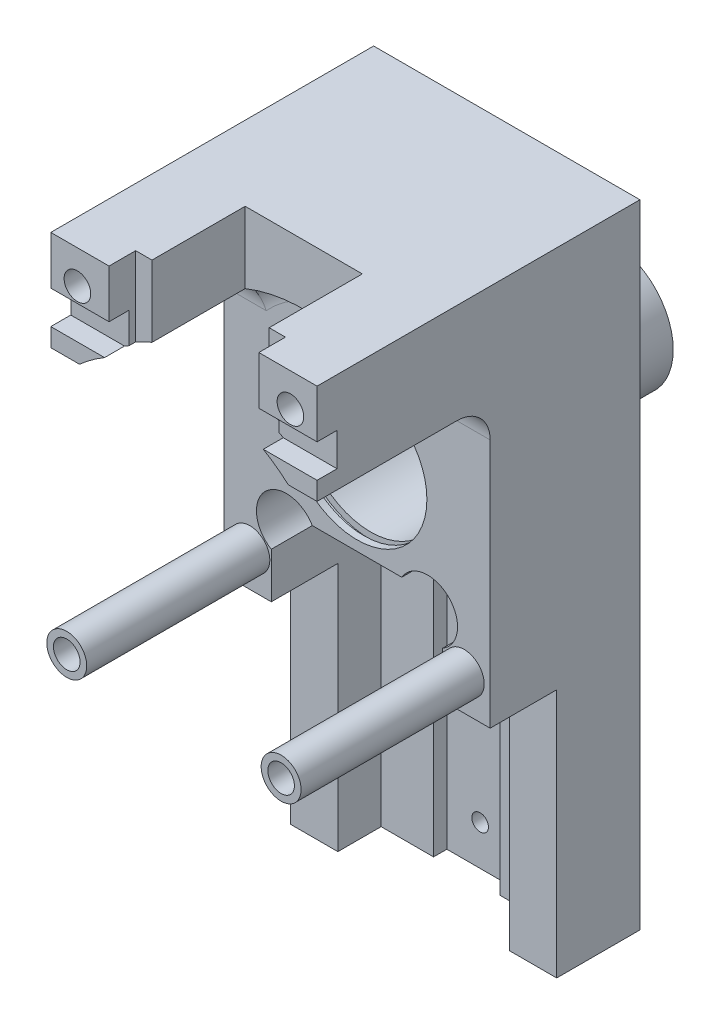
SolidWorks part; units mm, degrees
ref_plane "Ebene vorne" through (0, 0, 0) normal (0, 0, 1) x (1, 0, 0)
ref_plane "Ebene oben" through (0, 0, 0) normal (0, 1, 0) x (1, 0, 0)
ref_plane "Ebene rechts" through (0, 0, 0) normal (1, 0, 0) x (0, 0, -1)
sketch "Skizze1" plane through (0, 0, 0) normal (1, 0, 0) x (0, 0, -1)
  line L0 (-52, 72.5) -> (45, 72.5)
  line L1 (45, 72.5) -> (45, -117.5)
  line L2 (45, -117.5) -> (20, -117.5)
  line L3 (20, -117.5) -> (20, -42.5)
  line L4 (20, -42.5) -> (0, -42.5)
  line L5 (0, -42.5) -> (0, 42.5)
  line L6 (0, 42.5) -> (-52, 42.5)
  line L7 (-52, 42.5) -> (-52, 48)
  line L8 (-52, 48) -> (-46, 48)
  line L9 (-46, 48) -> (-46, 58)
  line L10 (-46, 58) -> (-52, 58)
  line L11 (-52, 58) -> (-52, 72.5)
  dimension "D1" = 85
  dimension "D2" = 190
  dimension "D3" = 97
  dimension "D4" = 25
  dimension "D5" = 75
  dimension "D6" = 45
  dimension "D7" = 91
  dimension "D8" = 10
  dimension "D9" = 14.5
extrude "Linear austragen1" add sketch "Skizze1" along normal mid plane 80
sketch "Skizze2" plane through (0, 0, -45) normal (0, 0, -1) x (-1, 0, 0)
  line L0 (0, -117.5) -> (0, 0) construction
  line L1 (-40, -117.5) -> (40, -117.5) construction
  circle A0 centre (0, 7.5) radius 19
  dimension "D1" = 38
  dimension "D2" = 125
extrude "Linear austragen2" add sketch "Skizze2" along normal blind 31
sketch "Skizze3" plane through (0, 0, -76) normal (0, 0, -1) x (-1, 0, 0)
  circle A0 centre (0, 7.5) radius 11.5
  dimension "D1" = 23
extrude "Schnitt-Linear austragen1" cut sketch "Skizze3" against normal up to next
sketch "Skizze4" plane through (0, 0, 0) normal (0, 0, 1) x (1, 0, 0)
  circle A0 centre (0, 7.5) radius 21
  dimension "D1" = 42
extrude "Schnitt-Linear austragen2" cut sketch "Skizze4" against normal blind 34
sketch "Skizze5" plane through (0, 0, -34) normal (0, 0, 1) x (1, 0, 0)
  circle A0 centre (0, 7.5) radius 18
  dimension "D1" = 36
extrude "Schnitt-Linear austragen3" cut sketch "Skizze5" against normal blind 4
ref_plane "Ebene1" through (0, 7.5, 0) normal (0, -1, 0) x (1, 0, 0)
sketch "Skizze7" plane through (0, 7.5, 0) normal (0, -1, 0) x (1, 0, 0)
  line L0 (21, 0) -> (-21, 0) construction
  line L1 (21, 0) -> (-21, 0) construction
  line L2 (21, -2.1) -> (23, -2.1)
  line L3 (23, -2.1) -> (23, -4.1)
  line L4 (23, -4.1) -> (21, -4.1)
  line L5 (21, -4.1) -> (21, -2.1)
  line L6 (40, 0) -> (-40, 0) construction
  line L7 (21, 0) -> (21, -20) construction
  line L8 (40, -20) -> (-40, -20) construction
  dimension "D1" = 4.1
  dimension "D2" = 2
  dimension "D3" = 2
ref_plane "Ebene2" through (0, 0, -4) normal (0, 0, 1) x (1, 0, 0)
sketch "Skizze8" plane through (0, 0, -4) normal (0, 0, 1) x (1, 0, 0)
  line L0 (21, 7.5) -> (-21, 7.5) construction
  circle A0 centre (0, 7.5) radius 17.5984
  dimension "D1" = 35.1967
sweep "Schnitt-Austragung1" cut profiles "Skizze7" path "Skizze8"
sketch "Skizze9" plane through (0, 0, 52) normal (0, 0, 1) x (1, 0, 0)
  line L1 (40, 72.5) -> (-40, 72.5) construction
  circle A0 centre (0, 7.5) radius 47
  dimension "D1" = 18
extrude "Schnitt-Linear austragen4" cut sketch "Skizze9" against normal up to surface (52 mm away)
sketch "Skizze12" plane through (0, 0, 52) normal (0, 0, 1) x (1, 0, 0)
  line L0 (0, 72.5) -> (0, -42.5) construction
  line L1 (40, 72.5) -> (-40, 72.5) construction
  line L2 (40, -42.5) -> (-40, -42.5) construction
  line L4 (-17.6, 72.5) -> (17.6, 72.5)
  line L5 (-17.6, 72.5) -> (-17.6, 47.5)
  line L6 (-17.6, 47.5) -> (17.6, 47.5)
  line L7 (17.6, 72.5) -> (17.6, 47.5)
  dimension "D1" = 25
  dimension "D2" = 35.2
extrude "Schnitt-Linear austragen5" cut sketch "Skizze12" against normal blind 36
fillet "Verrundung1" radius 10 3 edges at (35.6844, 42.5, 0) (-35.6844, 42.5, 0) (0, 54.5, 0)
hole_wizard "M8x1.25 Gewindebohrung1" positions "Skizze14" profile "Skizze13" tap size "M8x1.25" standard "Ansi Metrisch"
sketch "Skizze14" plane through (0, 0, 52) normal (0, 0, 1) x (1, 0, 0)
  line L0 (0, 72.5) -> (0, 0) construction
  line L1 (17.6, 72.5) -> (-17.6, 72.5) construction
  line L3 (-17.6, 72.5) -> (-40, 72.5) construction
  point P0 (32, 62.5)
  point P1 (-32, 62.5)
  dimension "D1" = 64
  dimension "D2" = 10
sketch "Skizze13" plane through (32, 62.5, 52) normal (1, 0, 0) x (0, -1, 0)
  line L0 (0, 0) -> (0, 24.2929)
  line L1 (0, 24.2929) -> (3.4, 22.25)
  line L2 (3.4, 22.25) -> (3.4, 16)
  line L3 (3.4, 16) -> (4, 16)
  line L4 (4, 16) -> (4, 0)
  line L5 (4, 0) -> (0, 0)
  line L10 (0, 24.2929) -> (-3.4, 22.25) construction
  line L11 (0, -6.35) -> (0, 107.95) construction
  dimension "Bohrerdurchmesser" = 6.8
  dimension "Bohrungstiefe" = 22.25
  dimension "Nenndurchmesser" = 8
  dimension "Gewindelänge" = 16
  dimension "Spitzenwinkel" = 118
sketch "Skizze15" plane through (0, 0, 0) normal (0, 0, 1) x (1, 0, 0)
  line L0 (0, 72.5) -> (0, -42.5) construction
  line L1 (17.6, 72.5) -> (-17.6, 72.5) construction
  line L2 (40, -42.5) -> (-40, -42.5) construction
  line L3 (40, 72.5) -> (17.6, 72.5) construction
  circle A0 centre (-32.2, -31.9) radius 6
  circle A1 centre (32.2, -31.9) radius 6
  dimension "D2" = 12
  dimension "D1" = 64.4
  dimension "D3" = 104.4
extrude "Linear austragen3" add sketch "Skizze15" along normal blind 55
hole_wizard "M8x1.25 Gewindebohrung2" positions "Skizze17" profile "Skizze16" tap size "M8x1.25" standard "Ansi Metrisch"
sketch "Skizze17" plane through (0, 0, 55) normal (0, 0, 1) x (1, 0, 0)
  point P0 (32.2, -31.9)
  point P1 (-32.2, -31.9)
sketch "Skizze16" plane through (32.2, -31.9, 55) normal (1, 0, 0) x (0, -1, 0)
  line L0 (0, 0) -> (0, 24.2929)
  line L1 (0, 24.2929) -> (3.4, 22.25)
  line L2 (3.4, 22.25) -> (3.4, 16)
  line L3 (3.4, 16) -> (4, 16)
  line L4 (4, 16) -> (4, 0)
  line L5 (4, 0) -> (0, 0)
  line L10 (0, 24.2929) -> (-3.4, 22.25) construction
  line L11 (0, -6.35) -> (0, 107.95) construction
  dimension "Bohrerdurchmesser" = 6.8
  dimension "Bohrungstiefe" = 22.25
  dimension "Nenndurchmesser" = 8
  dimension "Gewindelänge" = 16
  dimension "Spitzenwinkel" = 118
sketch "Skizze18" plane through (0, 0, 52) normal (0, 0, 1) x (1, 0, 0)
  line L0 (-17.6, 72.5) -> (-40, 72.5) construction
  line L1 (-22.5, 72.5) -> (22.5, 72.5)
  line L2 (-22.5, 72.5) -> (-22.5, 42.5)
  line L3 (-22.5, 42.5) -> (22.5, 42.5)
  line L4 (22.5, 72.5) -> (22.5, 42.5)
  line L5 (0, 0) -> (0, -117.5) construction
  line L6 (40, -117.5) -> (-40, -117.5) construction
  dimension "D1" = 45
  dimension "D2" = 30
extrude "Schnitt-Linear austragen6" cut sketch "Skizze18" against normal blind 8
sketch "Skizze19" plane through (0, 0, 0) normal (0, 0, 1) x (1, 0, 0)
  line L0 (40, -117.5) -> (-40, -117.5) construction
  line L1 (-13.4403, -16.5) -> (13.4403, -16.5)
  line L2 (-25.75, -28.8097) -> (-25.75, -117.5)
  line L3 (-25.75, -117.5) -> (25.75, -117.5)
  line L4 (25.75, -28.8097) -> (25.75, -117.5)
  line L5 (0, 0) -> (0, 72.5) construction
  line L6 (17.6, 72.5) -> (-17.6, 72.5) construction
  line L7 (-21.2132, -21.0368) -> (0, -42.25) construction
  line L9 (0, -42.25) -> (21.2132, -21.0368) construction
  line L10 (0, 0) -> (0, -117.5) construction
  line L11 (25.75, -28.8097) -> (25.75, -16.5) construction
  line L12 (25.75, -16.5) -> (13.4403, -16.5) construction
  line L13 (-13.4403, -16.5) -> (-25.75, -16.5) construction
  line L14 (-25.75, -16.5) -> (-25.75, -28.8097) construction
  arc A0 (-13.4403, -16.5) -> (-25.75, -28.8097) centre (-21.2132, -21.0368) ccw
  arc A1 (25.75, -28.8097) -> (13.4403, -16.5) centre (21.2132, -21.0368) ccw
  dimension "D3" = 18
  dimension "D1" = 101
  dimension "D2" = 51.5
  dimension "D4" = 45
  dimension "D5" = 45
  dimension "D6" = 30
  dimension "D7" = 30
extrude "Schnitt-Linear austragen7" cut sketch "Skizze19" against normal blind 33
sketch "Skizze20" plane through (0, 0, -33) normal (0, 0, 1) x (1, 0, 0)
  line L0 (-25.75, -117.5) -> (25.75, -117.5) construction
  line L1 (-10, -117.5) -> (10, -117.5)
  line L2 (-10, -117.5) -> (-10, -34.5)
  line L3 (-10, -16.5) -> (10, -16.5)
  line L4 (10, -117.5) -> (10, -34.5)
  line L5 (0, -16.5) -> (0, 0) construction
  line L6 (13.4403, -16.5) -> (-13.4403, -16.5) construction
  arc A0 (10, -34.5) -> (10, -16.5) centre (10, -25.5) ccw
  arc A1 (-10, -16.5) -> (-10, -34.5) centre (-10, -25.5) ccw
  dimension "D2" = 18
  dimension "D1" = 20
extrude "Schnitt-Linear austragen8" cut sketch "Skizze20" against normal blind 4
hole_wizard "M5x0.8 Gewindebohrung1" positions "Skizze22" profile "Skizze23" tap size "M5x0.8" standard "Ansi Metrisch"
sketch "Skizze22" plane through (0, 0, -37) normal (0, 0, 1) x (1, 0, 0)
  line L0 (0, 0) -> (0, -16.5) construction
  line L1 (13.4403, -16.5) -> (-13.4403, -16.5) construction
  line L3 (-10, -117.5) -> (10, -117.5) construction
  point P0 (0, -105.5)
  point P1 (0, -45.5)
  dimension "D1" = 12
  dimension "D2" = 60
sketch "Skizze23" plane through (0, -105.5, -37) normal (1, 0, 0) x (0, -1, 0)
  line L0 (0, 0) -> (0, 39)
  line L1 (0, 39) -> (2.5, 39)
  line L2 (2.5, 39) -> (2.5, 0)
  line L5 (2.5, 0) -> (0, 0)
  line L11 (0, -6.35) -> (0, 107.95) construction
  dimension "Nenndurchmesser (Haupt)" = 5
  dimension "Bohrungstiefe" = 39
